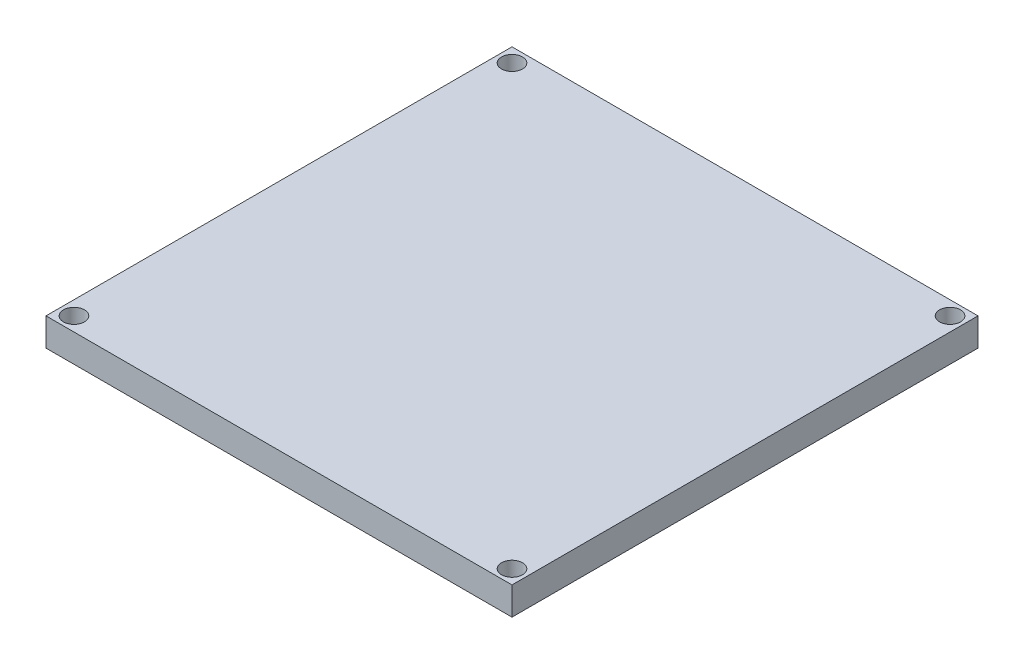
SolidWorks part; units mm, degrees
ref_plane "Front Plane" through (0, 0, 0) normal (0, 0, 1) x (1, 0, 0)
ref_plane "Top Plane" through (0, 0, 0) normal (0, 1, 0) x (1, 0, 0)
ref_plane "Right Plane" through (0, 0, 0) normal (1, 0, 0) x (0, 0, -1)
sketch "Sketch1" plane through (0, 0, 0) normal (0, 1, 0) x (1, 0, 0)
  line L1 (-50, -50) -> (50, -50)
  line L2 (-50, -50) -> (-50, 50)
  line L3 (-50, 50) -> (50, 50)
  line L4 (50, -50) -> (50, 50)
  line L5 (-50, -50) -> (50, 50) construction
  line L6 (-50, 50) -> (50, -50) construction
  point P0 (0, 0)
  dimension "D1" = 100
  dimension "D2" = 100
extrude "Boss-Extrude1" add sketch "Sketch1" along normal blind 6
sketch "Sketch2" plane through (0, 6, 0) normal (0, 1, 0) x (1, 0, 0)
  line L0 (-50, 50) -> (-50, -50) construction
  line L1 (50, 50) -> (-50, 50) construction
  circle A0 centre (-47, 47) radius 2.25
  circle A1 centre (47, 47) radius 2.25
  circle A2 centre (47, -47) radius 2.25
  circle A3 centre (-47, -47) radius 2.25
  point P15 (0, 0)
  dimension "D1" = 3
  dimension "D2" = 3
  dimension "D3" = 4
extrude "Cut-Extrude1" cut sketch "Sketch2" against normal through all
